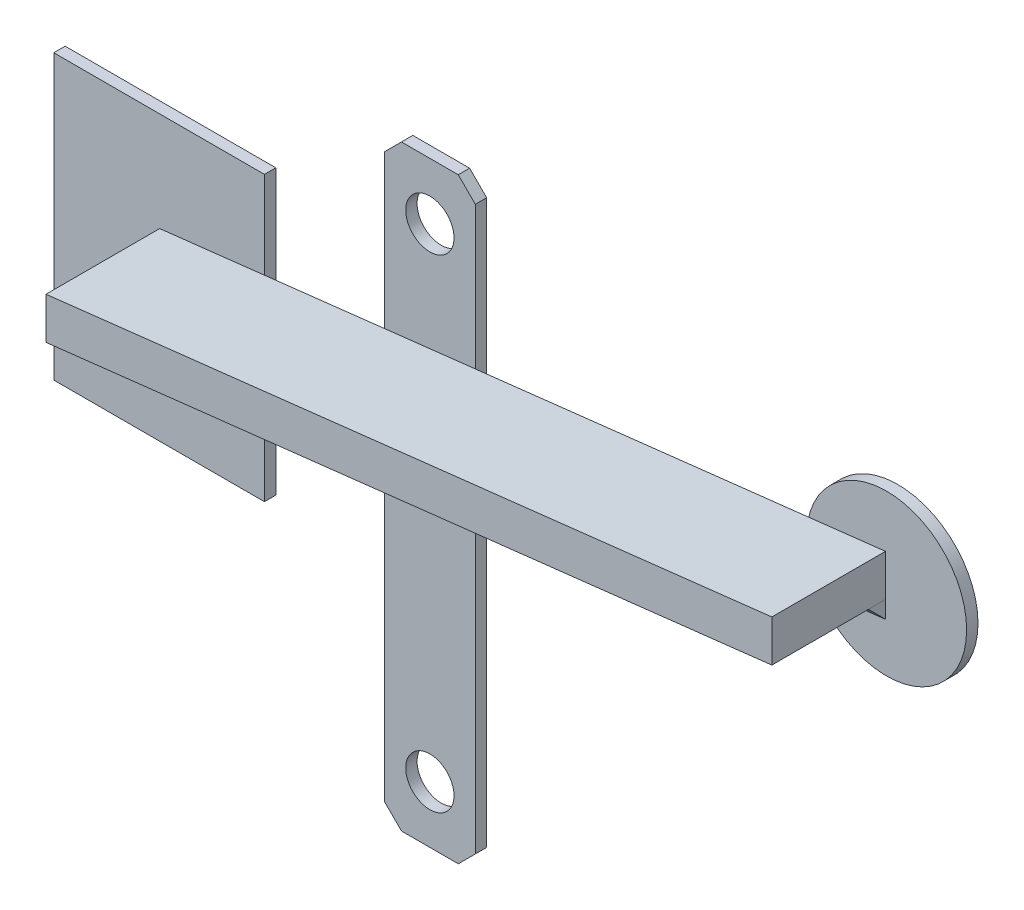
SolidWorks part; units mm, degrees
other "PoložkaDetailů1"
other "PoložkaDetailů2"
other "PoložkaDetailů3"
ref_plane "Přední rovina" through (0, 0, 0) normal (0, 0, 1) x (1, 0, 0)
ref_plane "Horní rovina" through (0, 0, 0) normal (0, 1, 0) x (1, 0, 0)
ref_plane "Pravá rovina" through (0, 0, 0) normal (1, 0, 0) x (0, 0, -1)
sketch "Skica1" plane through (0, 0, 0) normal (0, 0, 1) x (1, 0, 0)
  line L0 (-7.4943, 0) -> (0, 0) construction
  line L1 (-5, 52.5) -> (5, 52.5)
  line L2 (-8, 49.5) -> (-8, -49.5)
  line L3 (-5, -52.5) -> (5, -52.5)
  line L4 (8, 49.5) -> (8, -49.5)
  line L5 (0, 0) -> (0, 15.2471) construction
  line L6 (-8, 49.5) -> (-5, 52.5)
  line L7 (5, 52.5) -> (8, 49.5)
  line L8 (5, -52.5) -> (8, -49.5)
  line L9 (-5, -52.5) -> (-8, -49.5)
  line L11 (-66.1749, 35.5062) -> (-29.1098, 35.5062)
  line L12 (-66.1749, 35.5062) -> (-66.1749, -14.3757)
  line L13 (-66.1749, -14.3757) -> (-29.1098, -14.3757)
  line L14 (-29.1098, 35.5062) -> (-29.1098, -14.3757)
  circle A0 centre (0, 42.5) radius 4.25
  circle A1 centre (0, -42.5) radius 4.25
  arc A2 (-8, -49.5) -> (-5, -52.5) centre (-5, -49.5) ccw construction
  arc A3 (5, -52.5) -> (8, -49.5) centre (5, -49.5) ccw construction
  arc A4 (5, 52.5) -> (8, 49.5) centre (5, 49.5) cw construction
  arc A5 (-5, 52.5) -> (-8, 49.5) centre (-5, 49.5) ccw construction
  circle A6 centre (80.3533, 27.8854) radius 14.0927
  dimension "D2" = 85
  dimension "D3" = 8.5
  dimension "D5" = 3
  dimension "D1" = 105
  dimension "D4" = 16
extrude "Přidat vysunutím1" add sketch "Skica1" along normal blind 2
sketch "Skica2" plane through (0, 0, 2) normal (0, 0, 1) x (1, 0, 0)
  line L0 (-47.5429, 18.0249) -> (80.1688, 32.7032)
  line L1 (80.1688, 32.7032) -> (80.1688, 25.3641)
  line L2 (80.1688, 25.3641) -> (-47.5429, 10.6858)
  line L3 (-47.5429, 10.6858) -> (-47.5429, 18.0249)
extrude "Přidat vysunutím2" add sketch "Skica2" along normal blind 20 separate body
other "Koutový svar...1" parameters "D10"=6, "D11"=3, "D12"=0, "D13"=3, "D14"=0
other "Koutový svar...2" parameters "D10"=6, "D11"=3, "D12"=0, "D13"=3, "D14"=0
other "Koutový svar...3" parameters "D10"=6, "D11"=3, "D12"=0, "D13"=3, "D14"=0
